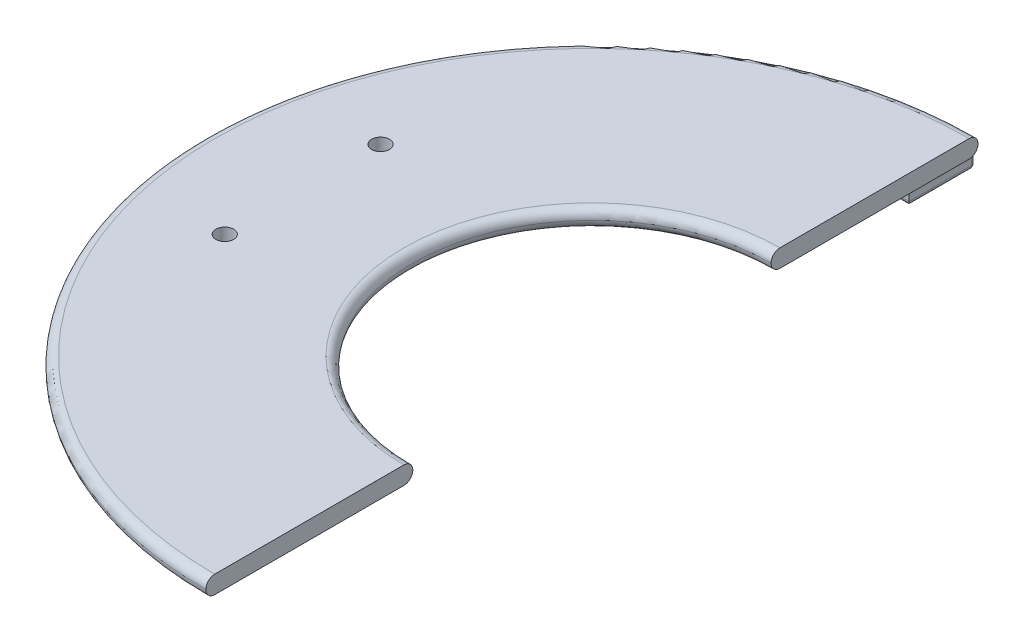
SolidWorks part; units mm, degrees
ref_plane "Front Plane" through (0, 0, 0) normal (0, 0, 1) x (1, 0, 0)
ref_plane "Top Plane" through (0, 0, 0) normal (0, 1, 0) x (1, 0, 0)
ref_plane "Right Plane" through (0, 0, 0) normal (1, 0, 0) x (0, 0, -1)
sketch "Sketch1" plane through (0, 0, 0) normal (0, 1, 0) x (1, 0, 0)
  line L0 (0, 86.75) -> (0, 40.25)
  line L1 (0, -40.25) -> (0, -86.75)
  arc A0 (0, 40.25) -> (0, -40.25) centre (0, 0) ccw
  arc A1 (0, 86.75) -> (0, -86.75) centre (0, 0) ccw
  dimension "D1" = 173.5
  dimension "D2" = 80.5
extrude "Boss-Extrude1" add sketch "Sketch1" along normal blind 4
sketch "Sketch2" plane through (0, 0, 0) normal (0, -1, 0) x (1, 0, 0)
  line L1 (-2.5, -83.75) -> (-14.5, -83.75)
  line L2 (-2.5, -83.75) -> (-2.5, -73.75)
  line L3 (-2.5, -73.75) -> (-14.5, -73.75)
  line L4 (-14.5, -83.75) -> (-14.5, -73.75)
  line L5 (0, -40.25) -> (0, -86.75) construction
  dimension "D1" = 12
  dimension "D2" = 10
  dimension "D3" = 3
  dimension "D4" = 2.5
extrude "Boss-Extrude2" add sketch "Sketch2" along normal blind 5
sketch "Sketch3" plane through (0, 0, -83.75) normal (0, 0, -1) x (-1, 0, 0)
  line L1 (2.5, -5) -> (14.5, -5)
  line L2 (2.5, -5) -> (2.5, -1.5)
  line L3 (2.5, -1.5) -> (14.5, -1.5)
  line L4 (14.5, -5) -> (14.5, -1.5)
  line L5 (14.5, -5) -> (14.5, 0) construction
  dimension "D1" = 3.5
extrude "Boss-Extrude3" add sketch "Sketch3" along normal blind 5
fillet "Fillet1" radius 1 9 edges at (-14.5, -5, -81.25) (-2.5, -5, -81.25) (-2.5, -1.5, -86.25) (-14.5, -1.5, -86.25) (-8.5, -5, -73.75) (-8.5, -5, -88.75) (-8.5, -1.5, -88.75) (-14.5, -3.25, -88.75) (-2.5, -3.25, -88.75)
fillet "Fillet2" radius 2 4 edges at (-86.75, 4, 0) (-40.25, 0, 0) (-86.75, 0, 0) (-40.25, 4, 0)
sketch "Sketch4" plane through (0, 4, 0) normal (0, 1, 0) x (1, 0, 0)
  line L0 (0, 0) -> (-65, 0) construction
  line L1 (-65, -17.5) -> (-65, 17.5) construction
  circle A0 centre (-65, -17.5) radius 2
  circle A1 centre (-65, 17.5) radius 2
  point P5 (-65, 0)
  dimension "D1" = 35
  dimension "D2" = 65
hole_wizard "Ø4.0mm Dowel Hole1" positions "3DSketch1" profile "Sketch5" hole size "Ø4.0" standard "ANSI Metric"
sketch3d "3DSketch1"
  point P0 (-65, 4, 17.5)
  point P3 (-65, 4, -17.5)
sketch "Sketch5" plane through (-65, 4, 17.5) normal (1, 0, 0) x (0, 0, 1)
  line L0 (0, 0) -> (0, 9)
  line L1 (0, 9) -> (2, 9)
  line L2 (2, 9) -> (2, 0)
  line L5 (2, 0) -> (0, 0)
  line L11 (0, -6.35) -> (0, 107.95) construction
  dimension "Thru Hole Dia." = 4
  dimension "Thru Hole Depth" = 9
